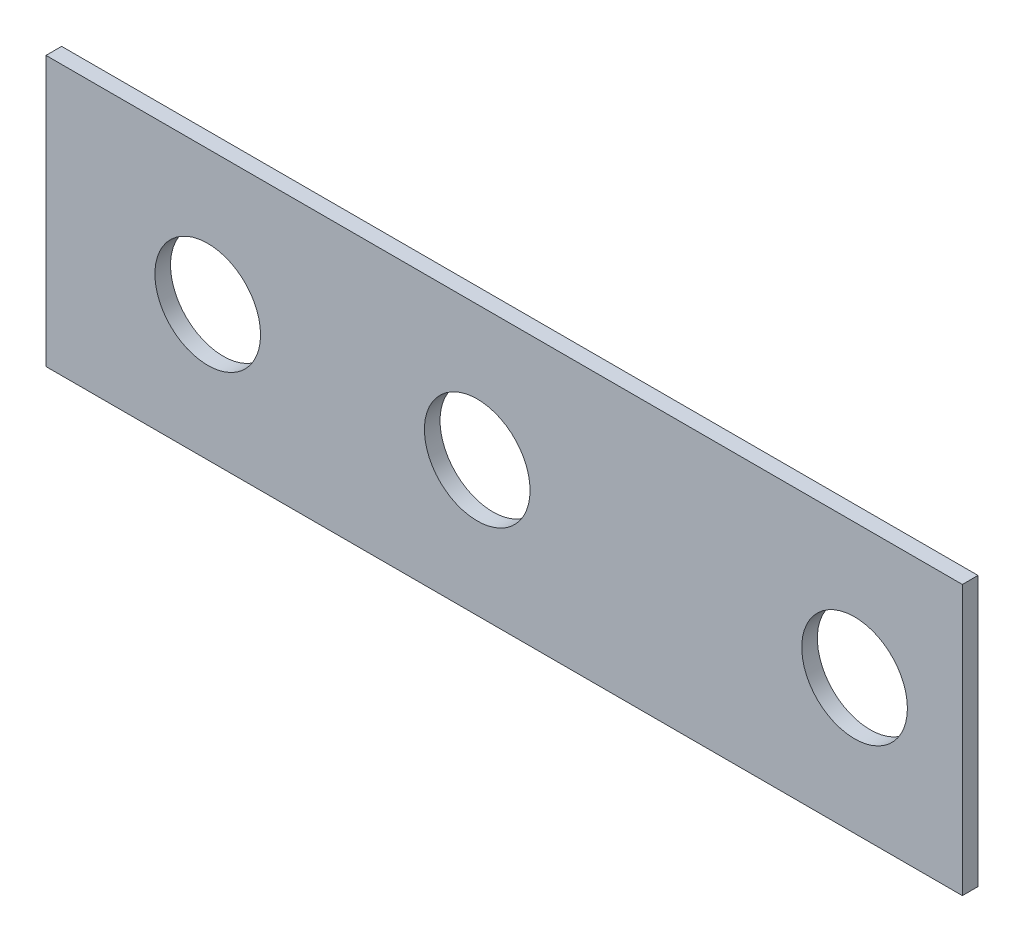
SolidWorks part; units mm, degrees
ref_plane "Front Plane" through (0, 0, 0) normal (0, 0, 1) x (1, 0, 0)
ref_plane "Top Plane" through (0, 0, 0) normal (0, 1, 0) x (1, 0, 0)
ref_plane "Right Plane" through (0, 0, 0) normal (1, 0, 0) x (0, 0, -1)
sketch "Sketch1" plane through (0, 0, 0) normal (0, 0, 1) x (1, 0, 0)
  line L0 (4.452, -19.0503) -> (9.532, -19.0503) construction
  line L1 (-28.568, -12.7003) -> (4.452, -12.7003)
  line L3 (-28.568, -25.4003) -> (4.452, -25.4003)
  line L5 (4.452, -12.7003) -> (14.612, -12.7003)
  line L6 (-28.568, -12.7003) -> (-28.568, -25.4003)
  line L7 (4.452, -25.4003) -> (14.612, -25.4003)
  line L8 (14.612, -12.7003) -> (14.612, -25.4003)
  line L9 (4.452, -19.0503) -> (-8.248, -19.0503) construction
  line L10 (4.452, -19.0503) -> (-20.948, -19.0503) construction
  circle A0 centre (9.532, -19.0503) radius 2.4892
  circle A1 centre (-8.248, -19.0503) radius 2.4892
  circle A2 centre (-20.948, -19.0503) radius 2.4892
base flange "Base-Flange1" sketch "Sketch1" thickness 0.7366 reverse thickness direction no parameters "D1"=0.7366
sketch "Bend-Lines1" [suppressed] plane through (0, 0, 0) normal (0, 1, 0) x (1, 0, 0)
sketch "Bounding-Box1" [suppressed] plane through (0, 0, 0) normal (0, 1, 0) x (1, 0, 0)
sheet metal parameters "Sheet-Metal1" thickness 0.7366 parameters "D1"=0.7366
flat pattern "Flat-Pattern1"
sketch "Bend-Lines2" plane through (0, 0, 0) normal (0, 1, 0) x (1, 0, 0)
sketch3d "Bounding-Box2" [suppressed]
  line L0 (28.568, -25.4003, 0) -> (-14.612, -25.4003, 0) construction
  line L1 (28.568, -12.7003, 0) -> (-14.612, -12.7003, 0) construction
  line L2 (28.568, -25.4003, 0) -> (28.568, -12.7003, 0) construction
  line L3 (-14.612, -25.4003, 0) -> (-14.612, -12.7003, 0) construction
